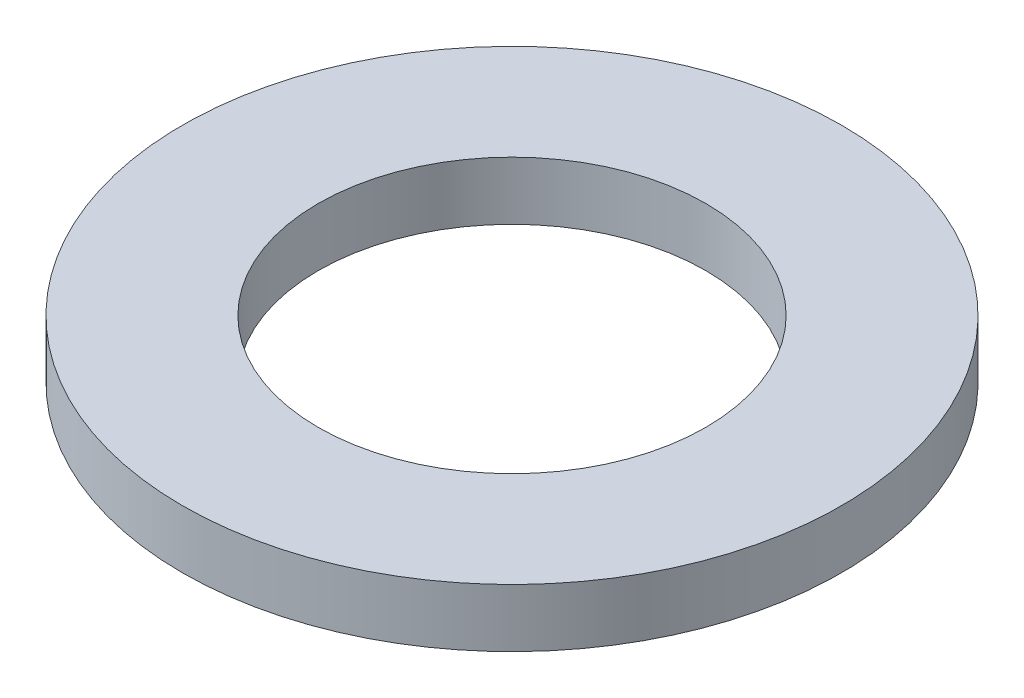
SolidWorks part; units mm, degrees
ref_plane "Front Plane" through (0, 0, 0) normal (0, 0, 1) x (1, 0, 0)
ref_plane "Top Plane" through (0, 0, 0) normal (0, 1, 0) x (1, 0, 0)
ref_plane "Right Plane" through (0, 0, 0) normal (1, 0, 0) x (0, 0, -1)
sketch "Sketch1" plane through (0, 0, 0) normal (0, 1, 0) x (1, 0, 0)
  circle A0 centre (0, 0) radius 25
  circle A1 centre (0, 0) radius 42.5
  dimension "D1" = 50
  dimension "D2" = 85
extrude "Extrude1" add sketch "Sketch1" along normal blind 7.5
